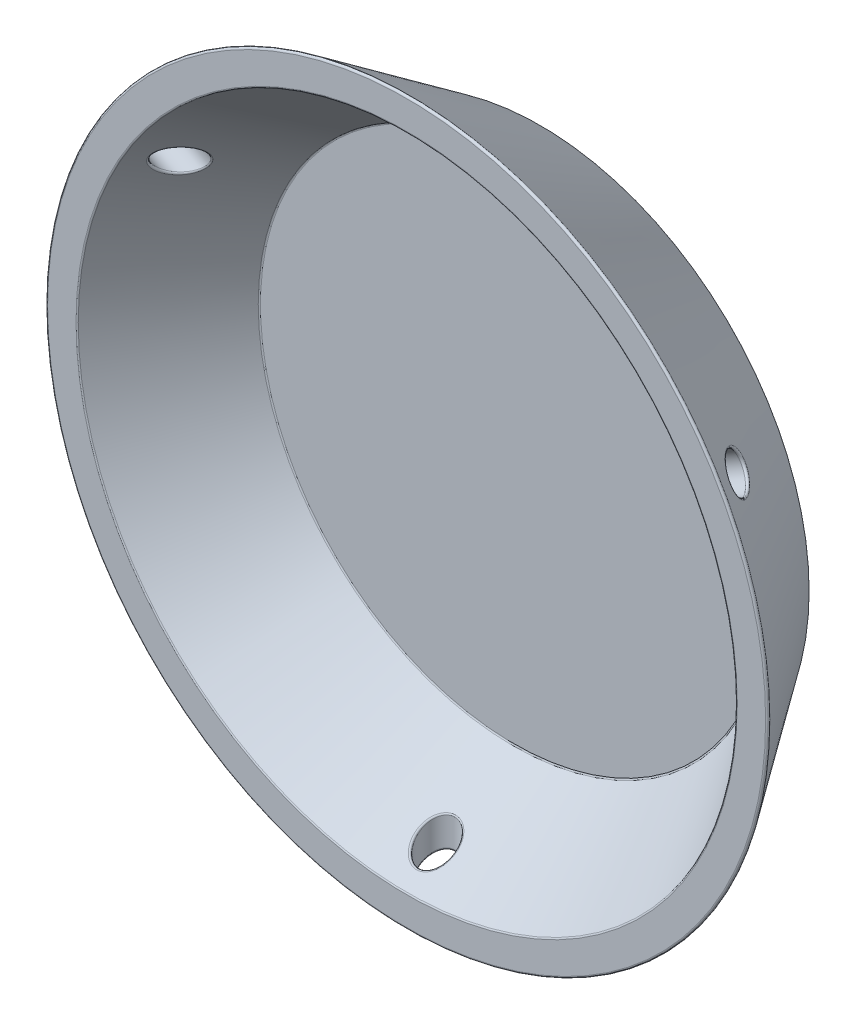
SolidWorks part; units mm, degrees
ref_plane "Ebene vorne" through (0, 0, 0) normal (0, 0, 1) x (1, 0, 0)
ref_plane "Ebene oben" through (0, 0, 0) normal (0, 1, 0) x (1, 0, 0)
ref_plane "Ebene rechts" through (0, 0, 0) normal (1, 0, 0) x (0, 0, -1)
sketch "Skizze1" plane through (0, 0, 0) normal (0, 0, 1) x (1, 0, 0)
  circle A0 centre (0, 0) radius 30
  dimension "D1" = 60
extrude "Aufsatz-Linear austragen1" add sketch "Skizze1" along normal blind 15 draft 35 contours A0
shell "Wandung1" thickness 3
sketch "Skizze3" plane through (0, 0, 0) normal (0, 1, 0) x (1, 0, 0)
  line L0 (-40.5031, -15) -> (40.5031, -15) construction
  circle A0 centre (-0.5962, -11) radius 2
  dimension "D2" = 4
  dimension "D1" = 4
extrude "Schnitt-Linear austragen1" cut sketch "Skizze3" against normal through all
pattern_circular "Kreismuster1" count 3 over 360 about axis through (0, 0, 1.7207) along (0, 0, 1) of "Schnitt-Linear austragen1"
fillet "Verrundung1" radius 0.2 1 edges at (40.5031, 0, 15)
fillet "Verrundung2" radius 0.2 1 edges at (36.8408, 0, 15)
fillet "Verrundung3" radius 0.2 1 edges at (28.4383, 0, 3)
fillet "Verrundung4" radius 0.2 1 edges at (30, 0, 0)
fillet "Verrundung5" radius 0.2 1 edges at (33.4812, 19.8188, 12.7208)
fillet "Verrundung6" radius 0.2 5 edges at (-29.3996, 19.1732, 12.5126) (-32.54, 21.0243, 12.4835) (0.9027, -36.764, 9.6759) (0.4604, -32.8477, 9.3019) (30.0115, 18.1746, 12.4935)
equation "\"1.5.00mm\"=20"
